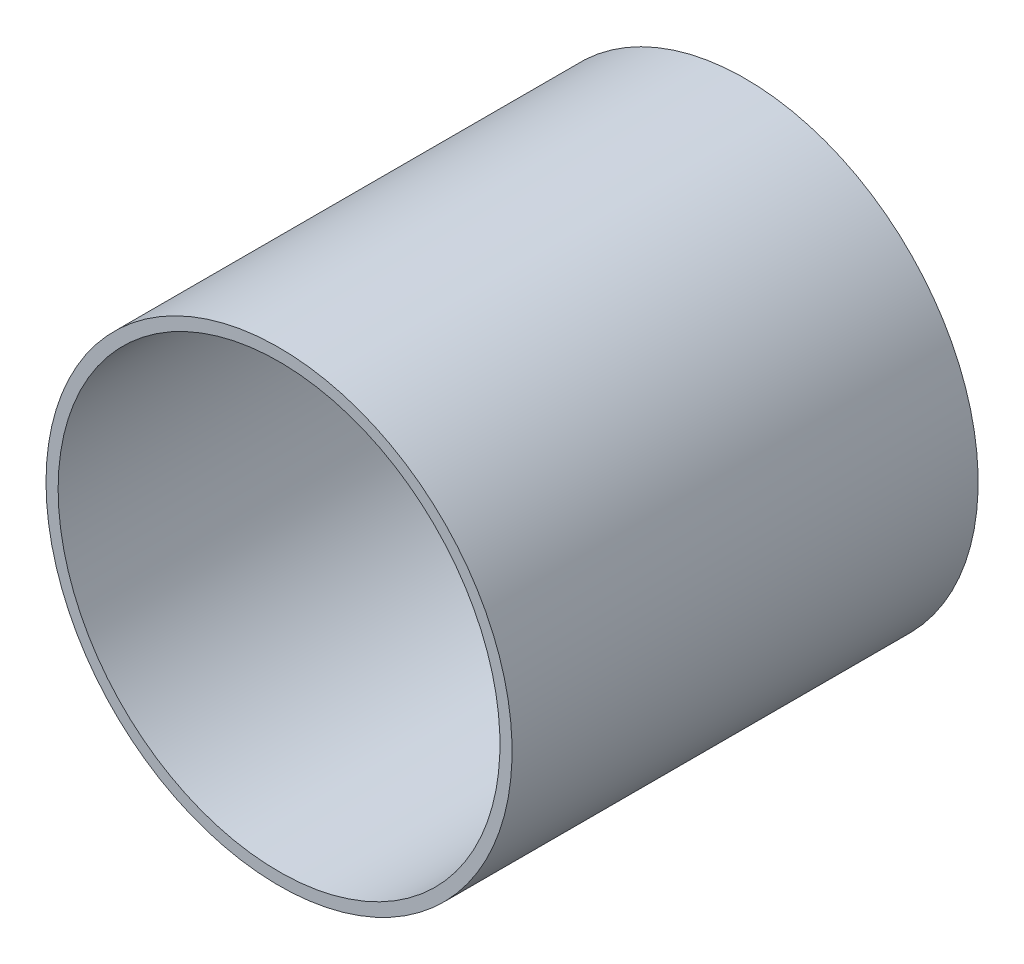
SolidWorks part; units mm, degrees
ref_plane "Front Plane" through (0, 0, 0) normal (0, 0, 1) x (1, 0, 0)
ref_plane "Top Plane" through (0, 0, 0) normal (0, 1, 0) x (1, 0, 0)
ref_plane "Right Plane" through (0, 0, 0) normal (1, 0, 0) x (0, 0, -1)
sketch "Sketch1" plane through (0, 0, 0) normal (0, 1, 0) x (1, 0, 0)
  line L0 (-30.099, 0) -> (-31.75, 0)
  line L1 (-31.75, 0) -> (-31.75, -6.35)
  line L3 (-31.75, -6.35) -> (-31.75, -63.5)
  line L4 (-31.75, -63.5) -> (-30.099, -63.5)
  line L5 (-30.099, -63.5) -> (-30.099, 0)
  line L6 (-30.099, 0) -> (0, 0) construction
  line L7 (0, 0) -> (0, -88.9) construction
  dimension "D1" = 63.5
  dimension "D2" = 31.75
  dimension "D3" = 1.651
  dimension "D4" = 6.35
revolve "Revolve1" add sketch "Sketch1" angle 360 about L7
